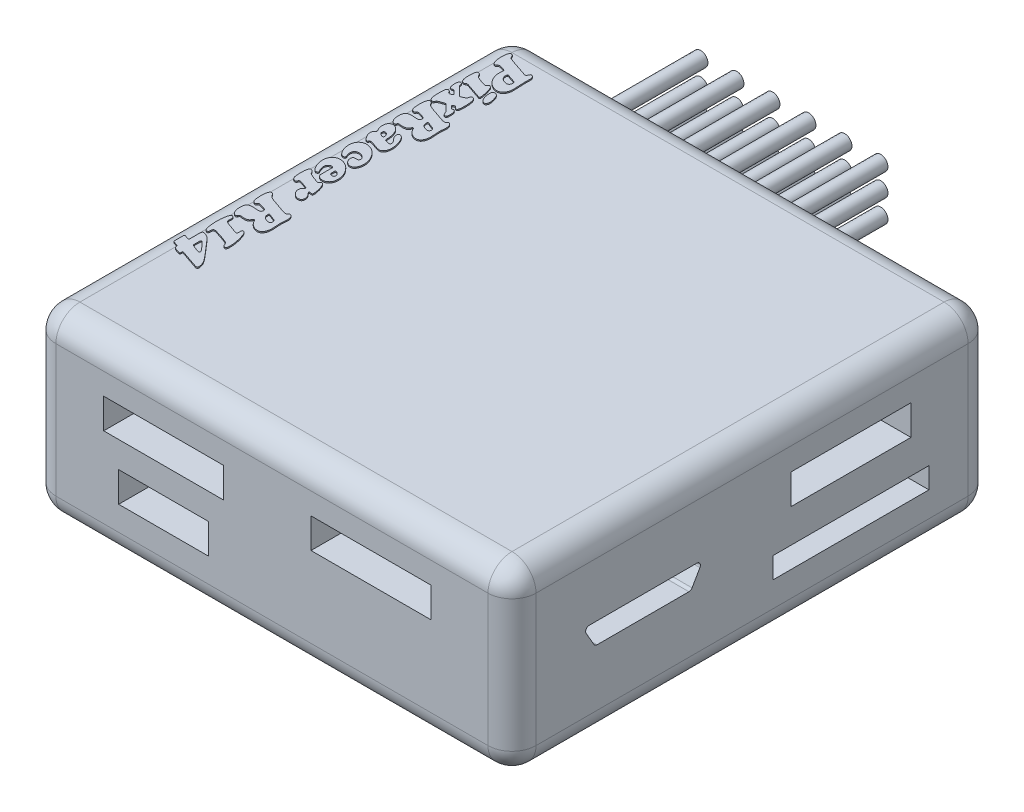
SolidWorks part; units mm, degrees
ref_plane "Ön Düzlem" through (0, 0, 0) normal (0, 0, 1) x (1, 0, 0)
ref_plane "Üst Düzlem" through (0, 0, 0) normal (0, 1, 0) x (1, 0, 0)
ref_plane "Sağ Düzlem" through (0, 0, 0) normal (1, 0, 0) x (0, 0, -1)
sketch "Çizim1" plane through (0, 0, 0) normal (0, 0, 1) x (1, 0, 0)
  line L1 (-37.3994, 1.1817) -> (2.6006, 1.1817)
  line L2 (-37.3994, 1.1817) -> (-37.3994, -13.8183)
  line L3 (-37.3994, -13.8183) -> (2.6006, -13.8183)
  line L4 (2.6006, 1.1817) -> (2.6006, -13.8183)
  dimension "D1" = 40
  dimension "D2" = 15
extrude "Yükseklik-Ekstrüzyon1" add sketch "Çizim1" along normal blind 40
fillet "Radyus1" radius 2 12 edges at (-17.3994, 1.1817, 40) (-17.3994, -13.8183, 40) (-17.3994, -13.8183, 0) (-17.3994, 1.1817, 0) (-37.3994, 1.1817, 20) (-37.3994, -6.3183, 40) (-37.3994, -13.8183, 20) (-37.3994, -6.3183, 0) (2.6006, -13.8183, 20) (2.6006, -6.3183, 40) (2.6006, 1.1817, 20) (2.6006, -6.3183, 0)
sketch "Çizim2" plane through (0, 0, 40) normal (0, 0, 1) x (1, 0, 0)
  line L1 (-31.4151, -2.6164) -> (-21.4151, -2.6164)
  line L2 (-31.4151, -2.6164) -> (-31.4151, -5.1164)
  line L3 (-31.4151, -5.1164) -> (-21.4151, -5.1164)
  line L4 (-21.4151, -2.6164) -> (-21.4151, -5.1164)
  line L5 (-30.1651, -7.2912) -> (-22.6651, -7.2912)
  line L6 (-30.1651, -7.2912) -> (-30.1651, -9.7912)
  line L7 (-30.1651, -9.7912) -> (-22.6651, -9.7912)
  line L8 (-22.6651, -7.2912) -> (-22.6651, -9.7912)
  line L9 (-14.1439, -2.6164) -> (-4.1439, -2.6164)
  line L10 (-14.1439, -2.6164) -> (-14.1439, -5.1164)
  line L11 (-14.1439, -5.1164) -> (-4.1439, -5.1164)
  line L12 (-4.1439, -2.6164) -> (-4.1439, -5.1164)
  point P8 (-26.4151, -2.6164)
  point P9 (-26.4151, -7.2912)
  point P15 (-14.1439, -3.8664)
  point P16 (-21.4151, -3.8664)
  dimension "D1" = 2.5
  dimension "D2" = 2.5
  dimension "D3" = 10
  dimension "D4" = 7.5
  dimension "D5" = 2.5
  dimension "D6" = 10
extrude "Kes-Ekstrüzyon1" cut sketch "Çizim2" against normal blind 5
sketch "Çizim3" plane through (0, 0, 0) normal (0, 0, -1) x (-1, 0, 0)
  line L1 (15.4788, -2.2028) -> (33.4788, -2.2028)
  line L2 (15.4788, -2.2028) -> (15.4788, -8.2028)
  line L3 (15.4788, -8.2028) -> (33.4788, -8.2028)
  line L4 (33.4788, -2.2028) -> (33.4788, -8.2028)
  line L5 (2.7596, -2.6189) -> (12.7596, -2.6189)
  line L6 (2.7596, -2.6189) -> (2.7596, -5.1189)
  line L7 (2.7596, -5.1189) -> (12.7596, -5.1189)
  line L8 (12.7596, -2.6189) -> (12.7596, -5.1189)
  line L9 (4.0096, -7.5323) -> (11.5096, -7.5323)
  line L10 (4.0096, -7.5323) -> (4.0096, -10.0323)
  line L11 (4.0096, -10.0323) -> (11.5096, -10.0323)
  line L12 (11.5096, -7.5323) -> (11.5096, -10.0323)
  point P12 (7.7596, -7.5323)
  point P13 (7.7596, -2.6189)
  dimension "D1" = 6
  dimension "D2" = 18
  dimension "D3" = 10
  dimension "D4" = 7.5
  dimension "D5" = 2.5
  dimension "D6" = 2.5
extrude "Kes-Ekstrüzyon2" cut sketch "Çizim3" against normal blind 5
sketch "Çizim4" plane through (0, 0, 5) normal (0, 0, -1) x (-1, 0, 0)
  line L0 (33.4788, -2.2028) -> (15.4788, -2.2028) construction
  line L1 (15.4788, -2.2028) -> (15.4788, -8.2028) construction
  circle A0 centre (16.6788, -3.4028) radius 0.6
  circle A1 centre (19.6788, -3.4028) radius 0.6
  circle A2 centre (22.6788, -3.4028) radius 0.6
  circle A3 centre (25.6788, -3.4028) radius 0.6
  circle A4 centre (28.6788, -3.4028) radius 0.6
  circle A5 centre (31.6788, -3.4028) radius 0.6
  circle A6 centre (19.6788, -5.3028) radius 0.6
  circle A7 centre (22.6788, -5.3028) radius 0.6
  circle A8 centre (25.6788, -5.3028) radius 0.6
  circle A9 centre (28.6788, -5.3028) radius 0.6
  circle A10 centre (31.6788, -5.3028) radius 0.6
  circle A11 centre (19.6788, -7.2028) radius 0.6
  circle A12 centre (22.6788, -7.2028) radius 0.6
  circle A13 centre (25.6788, -7.2028) radius 0.6
  circle A14 centre (28.6788, -7.2028) radius 0.6
  circle A15 centre (31.6788, -7.2028) radius 0.6
  circle A16 centre (16.6788, -5.3028) radius 0.6
  circle A17 centre (16.6788, -7.2028) radius 0.6
  dimension "D1" = 1.2
  dimension "D2" = 1.2
  dimension "D3" = 1.2
  dimension "D4" = 6
  dimension "D5" = 3
extrude "Yükseklik-Ekstrüzyon2" add sketch "Çizim4" along normal blind 15 contours A0 | A1 | A2 | A3 | A4 | A5 | A10 | A9 | A14 | A15 | A8 | A13 | A12 | A7 | A6 | A11 | A17 | A16
sketch "Çizim5" plane through (-37.3994, 0, 0) normal (-1, 0, 0) x (0, 0, 1)
  line L1 (5.4122, -7.614) -> (17.4122, -7.614)
  line L2 (5.4122, -7.614) -> (5.4122, -10.114)
  line L3 (5.4122, -10.114) -> (17.4122, -10.114)
  line L4 (17.4122, -7.614) -> (17.4122, -10.114)
  line L5 (25.1943, -2.6909) -> (33.1943, -2.6909)
  line L6 (25.1943, -2.6909) -> (25.1943, -5.1909)
  line L7 (25.1943, -5.1909) -> (33.1943, -5.1909)
  line L8 (33.1943, -2.6909) -> (33.1943, -5.1909)
  line L9 (24.1943, -7.614) -> (34.1943, -7.614)
  line L10 (24.1943, -7.614) -> (24.1943, -10.114)
  line L11 (24.1943, -10.114) -> (34.1943, -10.114)
  line L12 (34.1943, -7.614) -> (34.1943, -10.114)
  point P12 (29.1943, -2.6909)
  point P13 (29.1943, -7.614)
  point P14 (24.1943, -8.864)
  point P15 (5.4122, -8.864)
  dimension "D1" = 2.5
  dimension "D2" = 2.5
  dimension "D3" = 2.5
  dimension "D4" = 8
  dimension "D5" = 10
  dimension "D6" = 12
extrude "Kes-Ekstrüzyon3" cut sketch "Çizim5" against normal blind 5
sketch "Çizim6" plane through (2.6006, 0, 0) normal (1, 0, 0) x (0, 0, -1)
  line L0 (-33.566, -5.3557) -> (-24.6052, -5.3557)
  line L1 (-24.3454, -5.8057) -> (-24.999, -6.9378)
  line L2 (-25.2588, -7.0878) -> (-32.9124, -7.0878)
  line L3 (-33.1722, -6.9378) -> (-33.8258, -5.8057)
  line L5 (-16.7651, -2.7001) -> (-6.7651, -2.7001)
  line L6 (-16.7651, -2.7001) -> (-16.7651, -5.2001)
  line L7 (-16.7651, -5.2001) -> (-6.7651, -5.2001)
  line L8 (-6.7651, -2.7001) -> (-6.7651, -5.2001)
  line L9 (-18.2651, -7.9837) -> (-5.2651, -7.9837)
  line L10 (-18.2651, -7.9837) -> (-18.2651, -9.7337)
  line L11 (-18.2651, -9.7337) -> (-5.2651, -9.7337)
  line L12 (-5.2651, -7.9837) -> (-5.2651, -9.7337)
  arc A0 (-24.6052, -5.3557) -> (-24.3454, -5.8057) centre (-24.6052, -5.6557) cw
  arc A1 (-24.999, -6.9378) -> (-25.2588, -7.0878) centre (-25.2588, -6.7878) cw
  arc A2 (-32.9124, -7.0878) -> (-33.1722, -6.9378) centre (-32.9124, -6.7878) cw
  arc A3 (-33.566, -5.3557) -> (-33.8258, -5.8057) centre (-33.566, -5.6557) ccw
  point P6 (-24.0856, -5.3557)
  point P9 (-25.0856, -7.0878)
  point P12 (-33.0856, -7.0878)
  point P15 (-34.0856, -5.3557)
  point P24 (-11.7651, -2.7001)
  point P25 (-11.7651, -7.9837)
  dimension "D5" = 0.3
  dimension "D1" = 10
  dimension "D2" = 8
  dimension "D3" = 120
  dimension "D4" = 120
  dimension "D6" = 10
  dimension "D7" = 2.5
  dimension "D8" = 13
  dimension "D9" = 1.75
extrude "Kes-Ekstrüzyon4" cut sketch "Çizim6" against normal blind 5
sketch "Çizim7" plane through (0, 1.1817, 0) normal (0, 1, 0) x (1, 0, 0)
  text T0 "<i>PixRacer R14</i>" font "Cooper Black" height in points 12
extrude "Yükseklik-Ekstrüzyon4" add sketch "Çizim7" along normal blind 0.1 separate body
